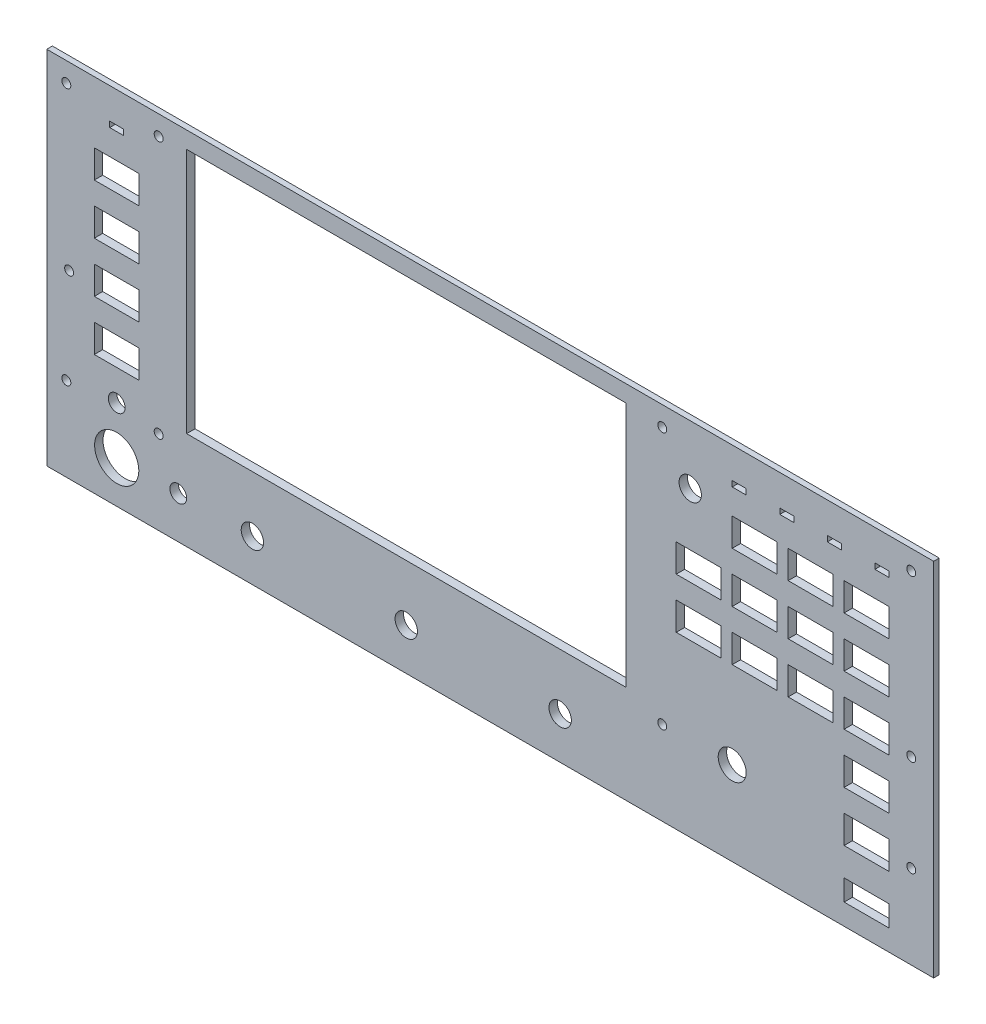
SolidWorks part; units mm, degrees
ref_plane "Front Plane" through (0, 0, 0) normal (0, 0, 1) x (1, 0, 0)
ref_plane "Top Plane" through (0, 0, 0) normal (0, 1, 0) x (1, 0, 0)
ref_plane "Right Plane" through (0, 0, 0) normal (1, 0, 0) x (0, 0, -1)
sketch "Sketch1" plane through (0, 0, 0) normal (0, 0, 1) x (1, 0, 0)
  line L1 (-158.5, 64.5) -> (158.5, 64.5)
  line L2 (-158.5, 64.5) -> (-158.5, -64.5)
  line L3 (-158.5, -64.5) -> (158.5, -64.5)
  line L4 (158.5, 64.5) -> (158.5, -64.5)
  line L5 (-158.5, 64.5) -> (158.5, -64.5) construction
  line L6 (-158.5, -64.5) -> (158.5, 64.5) construction
  point P0 (0, 0)
  dimension "D1" = 129
  dimension "D2" = 317
extrude "Boss-Extrude1" add sketch "Sketch1" along normal blind 3
sketch "Sketch2" plane through (0, 0, 3) normal (0, 0, 1) x (1, 0, 0)
  line L0 (0, 0) -> (-169.7549, 0) construction
  line L1 (-169.7549, 0) -> (198.7053, 0) construction
  line L2 (-158.5, 64.5) -> (-158.5, -64.5) construction
  line L3 (158.5, -64.5) -> (158.5, 64.5) construction
  circle A0 centre (-150.5, 0) radius 1.6
  circle A1 centre (150.5, 0) radius 1.6
  dimension "D1" = 8
  dimension "D2" = 8
extrude "Mounting holes" cut sketch "Sketch2" against normal through all
sketch "TFT" plane through (0, 0, 3) normal (0, 0, 1) x (1, 0, 0)
  line L0 (158.5, 64.5) -> (-158.5, 64.5) construction
  line L1 (-108.5, 58.5) -> (48.5, 58.5)
  line L2 (-108.5, 58.5) -> (-108.5, -29.5)
  line L3 (-108.5, -29.5) -> (48.5, -29.5)
  line L4 (48.5, 58.5) -> (48.5, -29.5)
  line L5 (-108.5, 58.5) -> (48.5, -29.5) construction
  line L6 (-108.5, -29.5) -> (48.5, 58.5) construction
  line L7 (-158.5, 64.5) -> (-158.5, -64.5) construction
  line L9 (-133.3298, 60.75) -> (76.4413, 60.75) construction
  line L10 (-111.115, -41.5) -> (55.5, -41.5) construction
  line L11 (-112.5, 63.9687) -> (-112.5, -44.2491) construction
  line L12 (55.5, 68.4116) -> (55.5, -38.2194) construction
  circle A0 centre (-118.5, -34.5) radius 1.6
  circle A1 centre (61.5, -34.5) radius 1.6
  circle A2 centre (61.5, 57.5) radius 1.6
  circle A3 centre (-118.5, 57.5) radius 1.6
  circle A4 centre (-151.5, -34.5) radius 1.6
  circle A5 centre (-151.5, 57.5) radius 1.6
  circle A6 centre (175.0291, 44.8253) radius 1.6
  circle A7 centre (150.5, -34.5) radius 1.6
  circle A8 centre (150.5, 57.5) radius 1.6
  point P0 (-30, 14.5)
  dimension "D7" = 2
  dimension "D1" = 157
  dimension "D2" = 88
  dimension "D3" = 50
  dimension "D4" = 128.5
  dimension "D5" = 4.5
  dimension "D6" = 12
  dimension "D8" = 49
  dimension "D9" = 88.5
  dimension "D10" = 4
  dimension "D11" = 7
  dimension "D13" = 6
  dimension "D14" = 7
  dimension "D15" = 309
  dimension "D12" = 2
extrude "Display + PCB" cut sketch "TFT" against normal through all
sketch "Sketch3" plane through (0, 0, 3) normal (0, 0, 1) x (1, 0, 0)
  line L0 (103.5, 53.5) -> (108.5, 53.5)
  line L1 (126.5, -29.5) -> (142.5, -29.5)
  line L2 (126.5, -29.5) -> (126.5, -39.5)
  line L3 (126.5, -39.5) -> (142.5, -39.5)
  line L4 (142.5, -29.5) -> (142.5, -39.5)
  line L5 (103.5, 53.5) -> (103.5, 51.5)
  line L6 (86.5, 53.5) -> (91.5, 53.5)
  line L7 (86.5, 53.5) -> (86.5, 51.5)
  line L8 (-158.5, -64.5) -> (158.5, -64.5) construction
  line L9 (-141.5, 24.5) -> (-125.5, 24.5)
  line L10 (-141.5, 24.5) -> (-141.5, 14.5)
  line L11 (-141.5, 14.5) -> (-125.5, 14.5)
  line L12 (-125.5, 24.5) -> (-125.5, 14.5)
  line L13 (-141.5, 6.5) -> (-125.5, 6.5)
  line L14 (-141.5, 6.5) -> (-141.5, -3.5)
  line L15 (-141.5, -3.5) -> (-125.5, -3.5)
  line L16 (-125.5, 6.5) -> (-125.5, -3.5)
  line L17 (-141.5, -11.5) -> (-125.5, -11.5)
  line L18 (-141.5, -11.5) -> (-141.5, -21.5)
  line L19 (-141.5, -21.5) -> (-125.5, -21.5)
  line L20 (-125.5, -11.5) -> (-125.5, -21.5)
  line L21 (103.5, 51.5) -> (108.5, 51.5)
  line L22 (86.5, 51.5) -> (91.5, 51.5)
  line L23 (91.5, 53.5) -> (91.5, 51.5)
  line L24 (-141.5, 42.5) -> (-125.5, 42.5)
  line L25 (-141.5, 42.5) -> (-141.5, 32.5)
  line L26 (-141.5, 32.5) -> (-125.5, 32.5)
  line L27 (-125.5, 42.5) -> (-125.5, 32.5)
  line L28 (108.5, 53.5) -> (108.5, 51.5)
  line L29 (120.5, 53.5) -> (125.5, 53.5)
  line L30 (120.5, 53.5) -> (120.5, 51.5)
  line L31 (120.5, 51.5) -> (125.5, 51.5)
  line L32 (125.5, 53.5) -> (125.5, 51.5)
  line L33 (137.5, 53.5) -> (142.5, 53.5)
  line L34 (137.5, 53.5) -> (137.5, 51.5)
  line L35 (137.5, 51.5) -> (142.5, 51.5)
  line L36 (142.5, 53.5) -> (142.5, 51.5)
  line L38 (-136, 51.5) -> (-131, 51.5)
  line L39 (-136, 51.5) -> (-136, 53.5)
  line L40 (-136, 53.5) -> (-131, 53.5)
  line L41 (-131, 51.5) -> (-131, 53.5)
  line L42 (126.5, -49.5) -> (142.5, -49.5)
  line L43 (126.5, -49.5) -> (126.5, -57)
  line L67 (106.5, 6.5) -> (122.5, 6.5)
  line L68 (-158.5, 64.5) -> (-158.5, -64.5) construction
  line L69 (106.5, 6.5) -> (106.5, -3.5)
  line L70 (106.5, -3.5) -> (122.5, -3.5)
  line L71 (122.5, 6.5) -> (122.5, -3.5)
  line L72 (86.5, 6.5) -> (102.5, 6.5)
  line L73 (86.5, 6.5) -> (86.5, -3.5)
  line L74 (86.5, -3.5) -> (102.5, -3.5)
  line L75 (102.5, 6.5) -> (102.5, -3.5)
  line L76 (66.5, 6.5) -> (82.5, 6.5)
  line L77 (126.5, -57) -> (142.5, -57)
  line L78 (142.5, -49.5) -> (142.5, -57)
  line L79 (66.5, 6.5) -> (66.5, -3.5)
  line L80 (66.5, -3.5) -> (82.5, -3.5)
  line L81 (82.5, 6.5) -> (82.5, -3.5)
  line L82 (106.5, 24.5) -> (122.5, 24.5)
  line L83 (106.5, 24.5) -> (106.5, 14.5)
  line L84 (106.5, 14.5) -> (122.5, 14.5)
  line L85 (122.5, 24.5) -> (122.5, 14.5)
  line L86 (86.5, 24.5) -> (102.5, 24.5)
  line L87 (86.5, 24.5) -> (86.5, 14.5)
  line L88 (86.5, 14.5) -> (102.5, 14.5)
  line L89 (102.5, 24.5) -> (102.5, 14.5)
  line L90 (66.5, 24.5) -> (82.5, 24.5)
  line L91 (66.5, 24.5) -> (66.5, 14.5)
  line L92 (66.5, 14.5) -> (82.5, 14.5)
  line L93 (82.5, 24.5) -> (82.5, 14.5)
  line L94 (106.5, 42.5) -> (122.5, 42.5)
  line L95 (106.5, 42.5) -> (106.5, 32.5)
  line L96 (106.5, 32.5) -> (122.5, 32.5)
  line L97 (122.5, 42.5) -> (122.5, 32.5)
  line L98 (86.5, 42.5) -> (102.5, 42.5)
  line L99 (86.5, 42.5) -> (86.5, 32.5)
  line L100 (86.5, 32.5) -> (102.5, 32.5)
  line L101 (102.5, 42.5) -> (102.5, 32.5)
  line L106 (126.5, -11.5) -> (142.5, -11.5)
  line L107 (126.5, -11.5) -> (126.5, -21.5)
  line L108 (126.5, -21.5) -> (142.5, -21.5)
  line L109 (142.5, -11.5) -> (142.5, -21.5)
  line L110 (126.5, 6.5) -> (142.5, 6.5)
  line L111 (126.5, 6.5) -> (126.5, -3.5)
  line L112 (126.5, -3.5) -> (142.5, -3.5)
  line L113 (142.5, 6.5) -> (142.5, -3.5)
  line L114 (126.5, 24.5) -> (142.5, 24.5)
  line L115 (126.5, 24.5) -> (126.5, 14.5)
  line L116 (126.5, 14.5) -> (142.5, 14.5)
  line L117 (142.5, 24.5) -> (142.5, 14.5)
  line L118 (126.5, 42.5) -> (142.5, 42.5)
  line L119 (126.5, 42.5) -> (126.5, 32.5)
  line L120 (126.5, 32.5) -> (142.5, 32.5)
  line L121 (142.5, 42.5) -> (142.5, 32.5)
  line L173 (66.5, -39.5) -> (82.5, -39.5)
  line L174 (66.5, -29.5) -> (82.5, -29.5)
  line L175 (66.5, -29.5) -> (66.5, -39.5)
  line L176 (82.5, -29.5) -> (82.5, -39.5)
  line L177 (102.5, -29.5) -> (102.5, -39.5)
  line L178 (86.5, -39.5) -> (102.5, -39.5)
  line L179 (86.5, -29.5) -> (102.5, -29.5)
  line L180 (106.5, -39.5) -> (122.5, -39.5)
  line L181 (106.5, -29.5) -> (122.5, -29.5)
  line L182 (106.5, -29.5) -> (106.5, -39.5)
  line L183 (122.5, -29.5) -> (122.5, -39.5)
  line L184 (66.5, 32.5) -> (82.5, 32.5)
  line L185 (82.5, 42.5) -> (82.5, 32.5)
  line L186 (66.5, 42.5) -> (82.5, 42.5)
  line L187 (66.5, 42.5) -> (66.5, 32.5)
  line L188 (106.5, -11.5) -> (122.5, -11.5)
  line L189 (106.5, -11.5) -> (106.5, -21.5)
  line L190 (106.5, -21.5) -> (122.5, -21.5)
  line L191 (122.5, -11.5) -> (122.5, -21.5)
  line L192 (86.5, -11.5) -> (102.5, -11.5)
  line L193 (86.5, -11.5) -> (86.5, -21.5)
  line L194 (86.5, -21.5) -> (102.5, -21.5)
  line L195 (102.5, -11.5) -> (102.5, -21.5)
  line L196 (66.5, -11.5) -> (82.5, -11.5)
  line L197 (66.5, -11.5) -> (66.5, -21.5)
  line L198 (66.5, -21.5) -> (82.5, -21.5)
  line L199 (82.5, -11.5) -> (82.5, -21.5)
  line L200 (86.5, -29.5) -> (86.5, -39.5)
  circle A0 centre (86.5, -34.5) radius 5
  circle A1 centre (-85, -49.5) radius 4
  circle A2 centre (-30, -49.5) radius 4
  circle A3 centre (25, -49.5) radius 4
  circle A4 centre (71.5, 43.5) radius 4
  circle A5 centre (-133.5, -49.5) radius 7.9
  circle A6 centre (-133.5, -32.5) radius 3
  circle A7 centre (-111.5, -49.5) radius 3
  point P10 (-141.5, 37.5)
  dimension "D1" = 16
  dimension "D25" = 25
  dimension "D26" = 25
  dimension "D38" = 230
  dimension "D41" = 17
  dimension "D2" = 10
  dimension "D3" = 128.5
  dimension "D4" = 55
  dimension "D5" = 55
  dimension "D8" = 245
  dimension "D9" = 285
  dimension "D10" = 30
  dimension "D11" = 17
  dimension "D12" = 25
  dimension "D13" = 4
  dimension "D14" = 18
  dimension "D15" = 10
  dimension "D16" = 16
  dimension "D18" = 2
  dimension "D19" = 2
  dimension "D20" = 5
  dimension "D21" = 5
  dimension "D23" = 245
  dimension "D24" = 116
  dimension "D22" = 22.5
  dimension "D27" = 22
  dimension "D28" = 15
  dimension "D29" = 15
  dimension "D30" = 15
  dimension "D31" = 15
  dimension "D32" = 32
  dimension "D33" = 108
  dimension "D34" = 16
  dimension "D35" = 7.5
  dimension "D36" = 7.5
  dimension "D37" = 0
  dimension "D40" = 43
  dimension "D17" = 4
  dimension "D6" = 4
  dimension "D7" = 5
extrude "Cutouts" cut sketch "Sketch3" against normal through all
sketch "Sketch4" plane through (0, 0, 0) normal (0, 0, -1) x (-1, 0, 0)
  line L1 (158.5, -64.5) -> (-158.5, -64.5)
  line L2 (158.5, -64.5) -> (158.5, 64.5)
  line L3 (158.5, 64.5) -> (-158.5, 64.5)
  line L4 (-158.5, -64.5) -> (-158.5, 64.5)
  line L5 (153.5, -59.5) -> (-153.5, -59.5)
  line L6 (153.5, -59.5) -> (153.5, 59.5)
  line L7 (153.5, 59.5) -> (-153.5, 59.5)
  line L8 (-153.5, -59.5) -> (-153.5, 59.5)
  dimension "D1" = 5
  dimension "D2" = 5
  dimension "D3" = 5
  dimension "D4" = 5
extrude "Cut-Extrude1" cut sketch "Sketch4" against normal blind 1
sketch "Labels" plane through (0, 0, 3) normal (0, 0, 1) x (1, 0, 0)
  line L0 (144.5645, 7.5) -> (61.8774, 7.5) construction
  line L1 (144.5645, -10.5) -> (-149.6841, -10.5) construction
  line L2 (82.5, 6.5) -> (66.5, 6.5) construction
  line L3 (146.0383, 25.5) -> (61.8774, 25.5) construction
  line L4 (148.4894, 43.5) -> (80.5106, 43.5) construction
  line L5 (144.5645, 54.5) -> (75.6096, 54.5) construction
  line L6 (82.5, 24.5) -> (66.5, 24.5) construction
  line L7 (102.5, 42.5) -> (86.5, 42.5) construction
  line L8 (91.5, 53.5) -> (86.5, 53.5) construction
  line L9 (144.5645, -28.5) -> (113.4924, -28.5) construction
  line L10 (144.5645, -48.5) -> (117.9013, -48.5) construction
  line L11 (61.8774, 7.5) -> (-148.176, 7.5) construction
  line L12 (61.8774, 25.5) -> (-145.8768, 25.5) construction
  line L13 (80.5106, 43.5) -> (-145.8768, 43.5) construction
  line L14 (75.6096, 54.5) -> (-153.4596, 54.5) construction
  line L15 (142.5, -11.5) -> (126.5, -11.5) construction
  line L16 (142.5, -29.5) -> (126.5, -29.5) construction
  line L17 (142.5, -49.5) -> (126.5, -49.5) construction
  line L18 (-133.5, -49.5) -> (-133.5, 59.419) construction
  line L19 (-142.1548, -27.5) -> (-123.5625, -27.5) construction
  line L20 (-143.6116, -39.3) -> (-124.1869, -39.3) construction
  line L21 (134.5, -60.9508) -> (134.5, 51.1148) construction
  line L22 (114.5, -17.8288) -> (114.5, 51.1148) construction
  line L23 (94.5, -7.5002) -> (94.5, 51.1148) construction
  line L24 (74.5, -7.5002) -> (74.5, 36.6547) construction
  line L25 (142.5, 32.5) -> (142.5, 42.5) construction
  line L26 (106.5, 6.5) -> (106.5, -3.5) construction
  line L27 (-103.7681, -59.0017) -> (36.6011, -59.0017) construction
  line L28 (86.5, 6.5) -> (86.5, -3.5) construction
  line L29 (66.5, 6.5) -> (66.5, -3.5) construction
  line L30 (-99.2336, -49.5) -> (-99.2336, -43.9898) construction
  line L31 (-99.2336, -43.9898) -> (-99.2336, -57.5096) construction
  line L32 (-44.7336, -46.1328) -> (-43.7336, -46.1328)
  line L33 (-99.7336, -46.1328) -> (-98.7336, -46.1328)
  line L34 (-99.7336, -46.1328) -> (-99.7336, -48.941)
  line L35 (-100.0821, -48.6515) -> (-100.4357, -48.2979)
  line L36 (-98.7336, -46.1328) -> (-98.7336, -48.941)
  line L37 (-98.3851, -48.6515) -> (-98.0315, -48.2979)
  line L38 (-44.7336, -46.1328) -> (-44.7336, -48.941)
  line L39 (-99.7336, -51.1248) -> (-99.7336, -53.8072)
  line L40 (-99.7336, -53.8072) -> (-98.7336, -53.8072)
  line L41 (-98.7336, -51.1248) -> (-98.7336, -53.8072)
  line L42 (-45.0821, -48.6515) -> (-45.4357, -48.2979)
  line L43 (-43.7336, -46.1328) -> (-43.7336, -48.941)
  line L44 (-43.3851, -48.6515) -> (-43.0315, -48.2979)
  line L45 (-44.7336, -51.1248) -> (-44.7336, -53.8072)
  line L46 (-44.7336, -53.8072) -> (-43.7336, -53.8072)
  line L47 (-43.7336, -51.1248) -> (-43.7336, -53.8072)
  line L48 (-44.2336, -49.5) -> (-44.2336, -43.9898) construction
  line L49 (10.2664, -46.1328) -> (11.2664, -46.1328)
  line L50 (10.2664, -46.1328) -> (10.2664, -48.941)
  line L51 (9.9179, -48.6515) -> (9.5643, -48.2979)
  line L52 (11.2664, -46.1328) -> (11.2664, -48.941)
  line L53 (11.6149, -48.6515) -> (11.9685, -48.2979)
  line L54 (10.2664, -51.1248) -> (10.2664, -53.8072)
  line L55 (10.2664, -53.8072) -> (11.2664, -53.8072)
  line L56 (11.2664, -51.1248) -> (11.2664, -53.8072)
  line L57 (10.7664, -49.5) -> (10.7664, -43.9898) construction
  line L58 (-100.9875, -43.1565) -> (39.3998, -43.1565) construction
  circle A0 centre (-133.5, -32.5) radius 3 construction
  arc A5 (-99.7336, -48.941) -> (-98.7336, -48.941) centre (-99.2336, -49.5) ccw
  arc A6 (-100.0821, -48.6515) -> (-98.3851, -48.6515) centre (-99.2336, -49.5) ccw
  arc A7 (-100.4357, -48.2979) -> (-99.7336, -51.1248) centre (-99.2336, -49.5) ccw
  arc A8 (-98.7336, -51.1248) -> (-98.0315, -48.2979) centre (-99.2336, -49.5) ccw
  arc A9 (-44.7336, -48.941) -> (-43.7336, -48.941) centre (-44.2336, -49.5) ccw
  arc A10 (-45.0821, -48.6515) -> (-43.3851, -48.6515) centre (-44.2336, -49.5) ccw
  arc A11 (-45.4357, -48.2979) -> (-44.7336, -51.1248) centre (-44.2336, -49.5) ccw
  arc A12 (-43.7336, -51.1248) -> (-43.0315, -48.2979) centre (-44.2336, -49.5) ccw
  arc A13 (10.2664, -48.941) -> (11.2664, -48.941) centre (10.7664, -49.5) ccw
  arc A14 (9.9179, -48.6515) -> (11.6149, -48.6515) centre (10.7664, -49.5) ccw
  arc A15 (9.5643, -48.2979) -> (10.2664, -51.1248) centre (10.7664, -49.5) ccw
  arc A16 (11.2664, -51.1248) -> (11.9685, -48.2979) centre (10.7664, -49.5) ccw
  text T0 "BAND -" font "Arial Narrow" height 3.5
  text T1 "MODE -" font "Arial Narrow" height 3.5
  text T2 "BAND +" font "Arial Narrow" height 3.5
  text T3 "MODE +" font "Arial Narrow" height 3.5
  text T4 "Lock" font "Arial Narrow" height 3.5
  text T5 "CTUN" font "Arial Narrow" height 3.5
  text T6 "NB" font "Arial Narrow" height 3.5
  text T7 "NR" font "Arial Narrow" height 3.5
  text T8 "SNB" font "Arial Narrow" height 3.5
  text T9 "A > B" font "Arial Narrow" height 3.5
  text T10 "A < B" font "Arial Narrow" height 3.5
  text T11 "POWER" font "Arial Narrow" height 3.5
  text T12 "PS" font "Arial Narrow" height 3.5
  text T13 "TUNE" font "Arial Narrow" height 3.5
  text T14 "SPLIT" font "Arial Narrow" height 3.5
  text T15 "A<>B" font "Arial Narrow" height 3.5
  text T16 "MOX" font "Arial Narrow" height 3.5
  text T17 "RUN" font "Arial Narrow" height 2.5
  text T18 "TX" font "Arial Narrow" height 2.5
  text T19 "- ADC -" font "Arial Narrow" height 2.5
  text T20 "75" font "Arial Narrow" height 2.5
  text T21 "100" font "Arial Narrow" height 2.5
  text T22 "AB5HM" font "Belgium" height 5.5
  text T23 "Hermes-Lite TRX" font "Belgium" height 4
  text T24 "USB" font "Arial Narrow" height 2.5
  text T25 "DRIVE" font "Arial Narrow" height 2.5
  text T26 "AF" font "Arial Narrow" height 2.5
  text T27 "IF WIDTH" font "Arial Narrow" height 2.5
  text T28 "IF SHIFT" font "Arial Narrow" height 2.5
  text T29 "ATT" font "Arial Narrow" height 2.5
  text T30 "AGC" font "Arial Narrow" height 2.5
  text T31 "MULTI" font "Arial Narrow" height 2.5
  text T32 "KEY" font "Arial Narrow" height 2.5
  point P74 (66.5, 1.5)
  point P88 (-99.2336, -47.588)
  point P91 (-99.2336, -52.2992)
  point P109 (-44.2336, -47.588)
  point P113 (-44.2336, -52.2992)
  point P127 (10.7664, -47.588)
  point P131 (10.7664, -52.2992)
  dimension "D8" = 5
  dimension "D14" = 1
  dimension "D15" = 3
  dimension "D1" = 1
  dimension "D2" = 1
  dimension "D3" = 1
  dimension "D4" = 1
  dimension "D5" = 1
  dimension "D6" = 1
  dimension "D7" = 1
  dimension "D9" = 10.2
  dimension "D10" = 8
  dimension "D11" = 8
  dimension "D12" = 8
  dimension "D13" = 8
